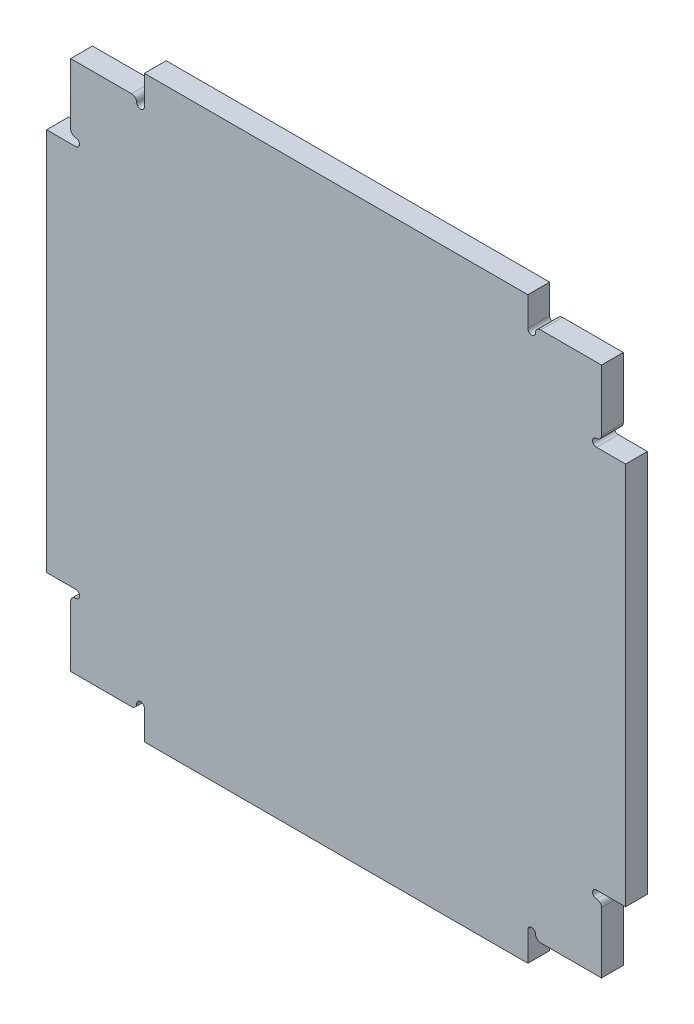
SolidWorks part; units mm, degrees
ref_plane "Front Plane" through (0, 0, 0) normal (0, 0, 1) x (1, 0, 0)
ref_plane "Top Plane" through (0, 0, 0) normal (0, 1, 0) x (1, 0, 0)
ref_plane "Right Plane" through (0, 0, 0) normal (1, 0, 0) x (0, 0, -1)
sketch "Sketch1" plane through (0, 0, 0) normal (0, 0, 1) x (1, 0, 0)
  line L0 (151.9474, -50.1645) -> (-207.5096, -460.1215) construction
sketch_block_instance "Block2-3"
sketch_block "Block2-2"
extrude "Boss-Extrude1" add sketch "Sketch1" along normal blind 17
equation "\"EndMill_HalfDiameter\"=3"
equation "\"D1@Block3\"=\"EndMill_HalfDiameter\""
equation "\"D2@Block3\"=\"EndMill_HalfDiameter\""
equation "\"D3@Block3\"=\"EndMill_HalfDiameter\""
equation "\"D4@Block3\"=\"EndMill_HalfDiameter\""
equation "\"D9@Block3\"=\"EndMill_HalfDiameter\""
equation "\"D10@Block3\"=\"EndMill_HalfDiameter\""
equation "\"D11@Block3\"=\"EndMill_HalfDiameter\""
equation "\"D12@Block3\"=\"EndMill_HalfDiameter\""
equation "\"WoodThickness\" = 17mm"
equation "\"D1@Boss-Extrude1\"=\"WoodThickness\""
equation "\"InnerLengthControl\"=47.5"
equation "\"D1@Block2-2\"=\"InnerLengthControl\""
equation "\"InnerWidth\"=299"
equation "\"D2@Block2-2\"=\"InnerWidth\""
equation "\"InnerLength\"=299"
equation "\"D3@Block2-2\"=\"InnerWidth\""
equation "\"D4@Block2-2\"=\"EndMill_HalfDiameter\""
